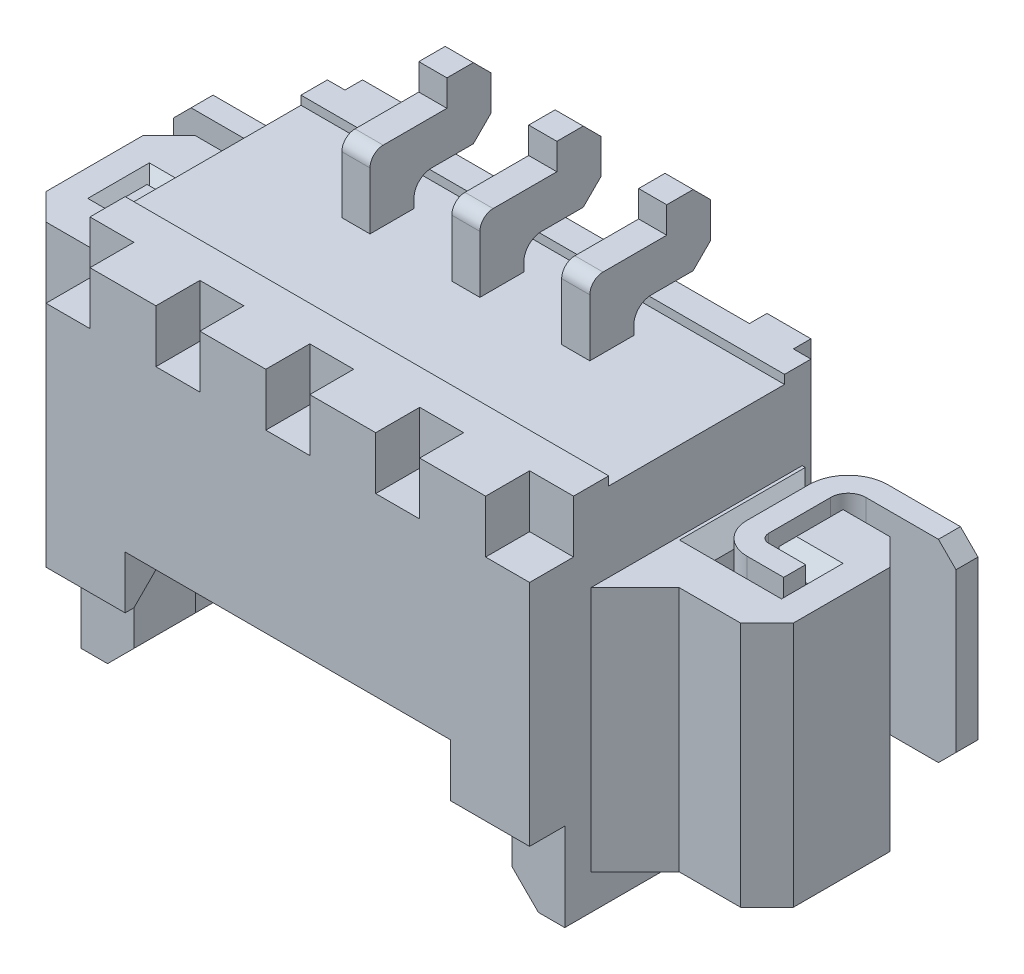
SolidWorks part; units mm, degrees
ref_plane "Front Plane" through (0, 0, 0) normal (0, 0, 1) x (1, 0, 0)
ref_plane "Top Plane" through (0, 0, 0) normal (0, 1, 0) x (1, 0, 0)
ref_plane "Right Plane" through (0, 0, 0) normal (1, 0, 0) x (0, 0, -1)
sketch "Origin_Ref" plane through (0, 0, 0) normal (0, 0, 1) x (1, 0, 0)
  line L0 (-4.25, -2.1) -> (-4.25, 2.1)
  line L1 (-4.25, 2.1) -> (4.25, 2.1)
  line L2 (4.25, 2.1) -> (4.25, -2.1)
  line L3 (4.25, -2.1) -> (-4.25, -2.1)
  line L4 (-2, -2.1) -> (-2, 2.1)
  line L5 (-2, 2.1) -> (2, 2.1)
  line L6 (2, 2.1) -> (2, -2.1)
  line L7 (2, -2.1) -> (-2, -2.1)
  line L8 (-1.15, 3.85) -> (-1.65, 4.6)
  line L9 (-1.65, 4.6) -> (-0.65, 4.6)
  line L10 (-0.65, 4.6) -> (-1.15, 3.85)
  line L11 (-1.905, 0) -> (1.905, 0)
  line L12 (0, -1.905) -> (0, 1.905)
  line L13 (-1.65, 2.1) -> (-1.65, 3.7)
  line L14 (-1.65, 3.7) -> (-0.85, 3.7)
  line L15 (-0.85, 3.7) -> (-0.85, 2.1)
  line L16 (-0.85, 2.1) -> (-1.65, 2.1)
  line L17 (-0.4, 2.1) -> (-0.4, 3.7)
  line L18 (-0.4, 3.7) -> (0.4, 3.7)
  line L19 (0.4, 3.7) -> (0.4, 2.1)
  line L20 (0.4, 2.1) -> (-0.4, 2.1)
  line L21 (0.85, 2.1) -> (0.85, 3.7)
  line L22 (0.85, 3.7) -> (1.65, 3.7)
  line L23 (1.65, 3.7) -> (1.65, 2.1)
  line L24 (1.65, 2.1) -> (0.85, 2.1)
  line L25 (-4.85, -1.5) -> (-4.85, 1.5)
  line L26 (-4.85, 1.5) -> (-2.75, 1.5)
  line L27 (-2.75, 1.5) -> (-2.75, -1.5)
  line L28 (-2.75, -1.5) -> (-4.85, -1.5)
  line L29 (2.75, -1.5) -> (2.75, 1.5)
  line L30 (2.75, 1.5) -> (4.85, 1.5)
  line L31 (4.85, 1.5) -> (4.85, -1.5)
  line L32 (4.85, -1.5) -> (2.75, -1.5)
  line L33 (-4.25, -2.1) -> (-4.25, 2.1)
  line L34 (-4.25, 2.1) -> (4.25, 2.1)
  line L35 (4.25, 2.1) -> (4.25, -2.1)
  line L36 (4.25, -2.1) -> (-4.25, -2.1)
  circle A0 centre (0, 0) radius 1
  text T0 "B" font "ARIAL" height 1
  text T1 "1" font "COURIER NEW" height 0.508
  text T2 "2" font "COURIER NEW" height 0.508
  text T3 "3" font "COURIER NEW" height 0.508
  text T4 "M1" font "COURIER NEW" height 0.508
  text T5 "M2" font "COURIER NEW" height 0.508
imported_body "Imported1"
move or copy body "Body-Move/Copy1" bodies to move or copy 101 copy no rotation origin (0, -1.6251, 0) rotation axis (0, 0, 1) rotation angle 180
move or copy body "Body-Move/Copy2" bodies to move or copy 102 copy no translate (0, 2.1251, 0)
move or copy body "Body-Move/Copy3" bodies to move or copy 103 copy no translate (0, 0, 1.8)
